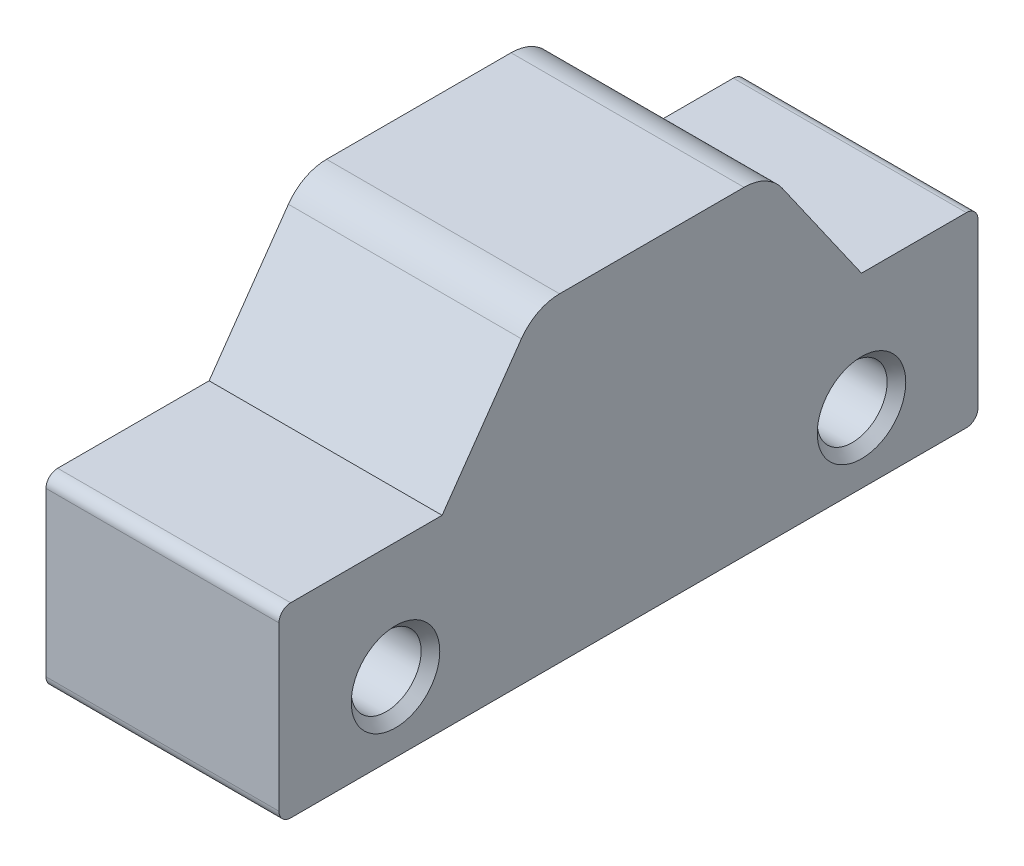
SolidWorks part; units mm, degrees
ref_plane "Front Plane" through (0, 0, 0) normal (0, 0, 1) x (1, 0, 0)
ref_plane "Top Plane" through (0, 0, 0) normal (0, 1, 0) x (1, 0, 0)
ref_plane "Right Plane" through (0, 0, 0) normal (1, 0, 0) x (0, 0, -1)
sketch "Sketch2" plane through (0, 0, 0) normal (1, 0, 0) x (0, 0, -1)
  line L0 (-75, 0) -> (75, 0)
  line L1 (75, 0) -> (75, 40)
  line L2 (75, 40) -> (50, 40)
  line L3 (-75, 40) -> (-75, 0)
  line L4 (-40, 40) -> (-20, 68.563)
  line L5 (-20, 68.563) -> (30, 68.563)
  line L6 (30, 68.563) -> (50, 40)
  line L7 (-40, 40) -> (-75, 40)
  point P4 (0, 0)
  dimension "D1" = 40
  dimension "D2" = 150
  dimension "D3" = 35
  dimension "D4" = 25
  dimension "D5" = 125
  dimension "D6" = 125
  dimension "D7" = 50
extrude "Boss-Extrude1" add sketch "Sketch2" along normal mid plane 50 contours L4 L5 L6 L2 L1 L0 L3 L7
sketch "Sketch3" plane through (25, 0, 0) normal (1, 0, 0) x (0, 0, -1)
  line L0 (-75, 40) -> (-75, 0) construction
  line L1 (-75, 0) -> (75, 0) construction
  circle A0 centre (-50, 15) radius 7.5
  dimension "D1" = 15
  dimension "D2" = 25
  dimension "D3" = 15
extrude "Cut-Extrude1" cut sketch "Sketch3" against normal through all
chamfer "Chamfer1" distance 2 angle 45 2 edges at (-25, 15, 42.5) (25, 15, 42.5)
pattern_linear "LPattern1" count 2 spacing 100 along (0, 0, -1) of "Cut-Extrude1", "Chamfer1"
fillet "Fillet1" radius 10 2 edges at (0, 68.563, -30) (0, 68.563, 20)
fillet "Fillet2" radius 2.5 4 edges at (0, 0, -75) (0, 0, 75) (0, 40, -75) (0, 40, 75)
